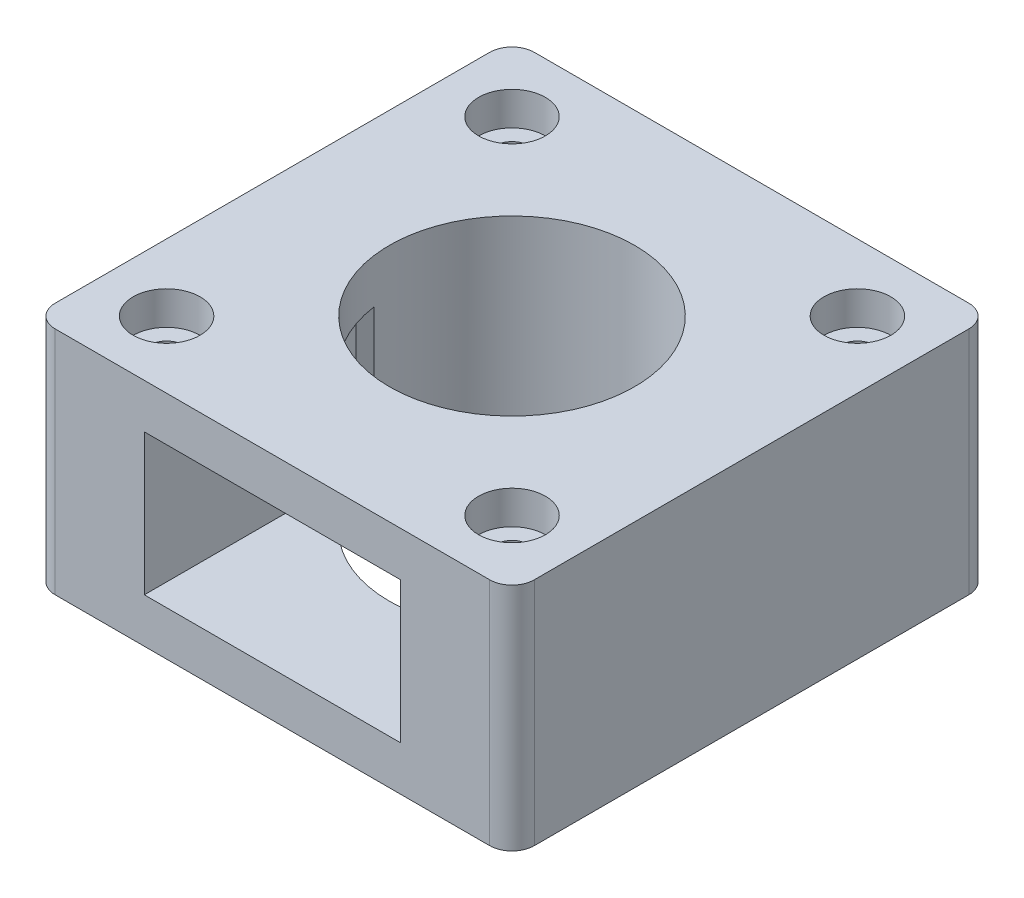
SolidWorks part; units mm, degrees
ref_plane "Front Plane" through (0, 0, 0) normal (0, 0, 1) x (1, 0, 0)
ref_plane "Top Plane" through (0, 0, 0) normal (0, 1, 0) x (1, 0, 0)
ref_plane "Right Plane" through (0, 0, 0) normal (1, 0, 0) x (0, 0, -1)
sketch "Sketch1" plane through (0, 0, 0) normal (0, 1, 0) x (1, 0, 0)
  line L1 (-21.5, -21.5) -> (21.5, -21.5)
  line L2 (-21.5, -21.5) -> (-21.5, 21.5)
  line L3 (-21.5, 21.5) -> (21.5, 21.5)
  line L4 (21.5, -21.5) -> (21.5, 21.5)
  line L5 (-21.5, -21.5) -> (21.5, 21.5) construction
  line L6 (-21.5, 21.5) -> (21.5, -21.5) construction
  circle A0 centre (0, 0) radius 11
  point P0 (0, 0)
  dimension "D2" = 22
  dimension "D1" = 43
extrude "Boss-Extrude1" add sketch "Sketch1" along normal blind 20.67
sketch "Sketch2" plane through (0, 0, 0) normal (0, -1, 0) x (1, 0, 0)
  circle A0 centre (0, 0) radius 12.5
  dimension "D1" = 25
extrude "Cut-Extrude1" cut sketch "Sketch2" against normal blind 3
sketch "Sketch3" plane through (0, 20.67, 0) normal (0, 1, 0) x (1, 0, 0)
  line L1 (-15.5, -15.5) -> (15.5, -15.5) construction
  line L2 (-15.5, -15.5) -> (-15.5, 15.5) construction
  line L3 (-15.5, 15.5) -> (15.5, 15.5) construction
  line L4 (15.5, -15.5) -> (15.5, 15.5) construction
  line L5 (-15.5, -15.5) -> (15.5, 15.5) construction
  line L6 (-15.5, 15.5) -> (15.5, -15.5) construction
  circle A0 centre (-15.5, 15.5) radius 1.5
  circle A1 centre (15.5, 15.5) radius 1.5
  circle A2 centre (15.5, -15.5) radius 1.5
  circle A3 centre (-15.5, -15.5) radius 1.5
  point P0 (0, 0)
  point P16 (0, 0)
  dimension "D2" = 3
  dimension "D1" = 31
  dimension "D3" = 4
extrude "Cut-Extrude2" cut sketch "Sketch3" against normal through all
sketch "Sketch4" plane through (0, 0, 21.5) normal (0, 0, 1) x (1, 0, 0)
  line L0 (-21.5, 20.67) -> (21.5, 20.67) construction
  line L1 (-11.5, 4) -> (11.5, 4)
  line L2 (-11.5, 4) -> (-11.5, 16.67)
  line L3 (-11.5, 16.67) -> (11.5, 16.67)
  line L4 (11.5, 4) -> (11.5, 16.67)
  line L5 (-11.5, 4) -> (11.5, 16.67) construction
  line L6 (-11.5, 16.67) -> (11.5, 4) construction
  line L7 (-21.5, 0) -> (21.5, 0) construction
  line L8 (-21.5, 20.67) -> (-21.5, 0) construction
  line L9 (21.5, 20.67) -> (21.5, 0) construction
  point P0 (0, 10.335)
  dimension "D1" = 4
  dimension "D2" = 4
  dimension "D3" = 10
  dimension "D4" = 10
extrude "Cut-Extrude3" cut sketch "Sketch4" against normal blind 20
sketch "Sketch5" plane through (0, 20.67, 0) normal (0, 1, 0) x (1, 0, 0)
  circle A0 centre (-15.5, 15.5) radius 3
  circle A1 centre (15.5, 15.5) radius 3
  circle A2 centre (15.5, -15.5) radius 3
  circle A3 centre (-15.5, -15.5) radius 3
  point P12 (0, 0)
  dimension "D1" = 6
  dimension "D2" = 4
extrude "Cut-Extrude4" cut sketch "Sketch5" against normal blind 3
fillet "Fillet1" radius 2 4 edges at (-21.5, 10.335, 21.5) (-21.5, 10.335, -21.5) (21.5, 10.335, 21.5) (21.5, 10.335, -21.5)
chamfer "Chamfer1" distance 1 angle 31 2 edges at (-11.5, 10.335, 1.5) (11.5, 10.335, 1.5)
